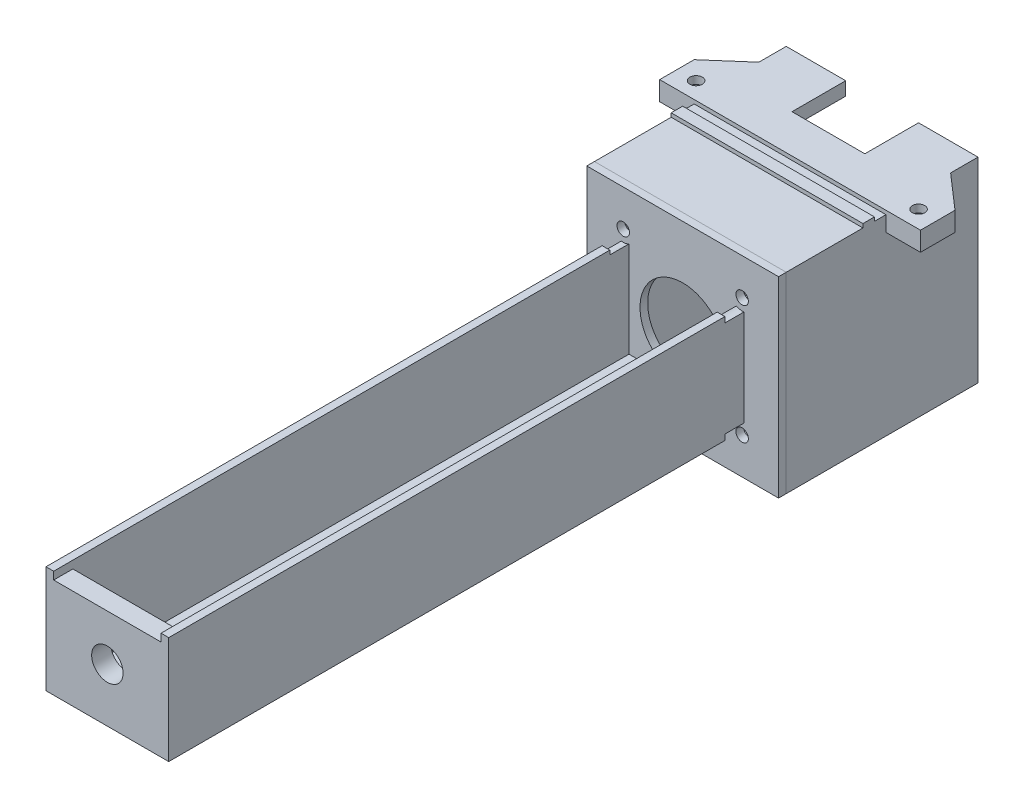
SolidWorks part; units mm, degrees
ref_plane "Front Plane" through (0, 0, 0) normal (0, 0, 1) x (1, 0, 0)
ref_plane "Top Plane" through (0, 0, 0) normal (0, 1, 0) x (1, 0, 0)
ref_plane "Right Plane" through (0, 0, 0) normal (1, 0, 0) x (0, 0, -1)
sketch "Croquis1" plane through (0, 0, 0) normal (0, 0, 1) x (1, 0, 0)
  line L1 (-22.5, -22.5) -> (22.5, -22.5)
  line L2 (-22.5, -22.5) -> (-22.5, 22.5)
  line L3 (-22.5, 22.5) -> (22.5, 22.5)
  line L4 (22.5, -22.5) -> (22.5, 22.5)
  line L5 (-22.5, -22.5) -> (22.5, 22.5) construction
  line L6 (-22.5, 22.5) -> (22.5, -22.5) construction
  line L7 (-25, -25) -> (25, -25)
  line L8 (-25, -25) -> (-25, 25)
  line L9 (-25, 25) -> (25, 25)
  line L10 (25, -25) -> (25, 25)
  line L11 (-25, -25) -> (25, 25) construction
  line L12 (-25, 25) -> (25, -25) construction
  point P0 (0, 0)
  point P5 (0, 0)
  dimension "D1" = 45
  dimension "D2" = 45
  dimension "D3" = 50
  dimension "D4" = 50
extrude "Saliente-Extruir1" add sketch "Croquis1" along normal blind 50
sketch "Croquis2" plane through (0, 0, 50) normal (0, 0, 1) x (1, 0, 0)
  line L0 (25, -25) -> (25, 25) construction
  line L1 (-25, -25) -> (25, -25)
  line L2 (-25, -25) -> (-25, 25)
  line L3 (-25, 25) -> (25, 25)
  line L4 (25, -25) -> (25, 25)
  line L5 (-25, -25) -> (25, 25) construction
  line L6 (-25, 25) -> (25, -25) construction
  line L11 (-15.5, -15.5) -> (15.5, 15.5) construction
  line L12 (-15.5, 15.5) -> (15.5, -15.5) construction
  line L17 (-11, -11) -> (11, 11) construction
  line L18 (-11, 11) -> (11, -11) construction
  circle A0 centre (-15.5, 15.5) radius 1.625
  circle A1 centre (15.5, 15.5) radius 1.625
  circle A2 centre (15.5, -15.5) radius 1.625
  circle A3 centre (-15.5, -15.5) radius 1.625
  circle A4 centre (0, 0) radius 11.125
  point P0 (0, 0)
  point P5 (0, 0)
  point P16 (0, 0)
  dimension "D3" = 3.25
  dimension "D4" = 3.25
  dimension "D5" = 3.25
  dimension "D6" = 3.25
  dimension "D9" = 22.25
  dimension "D1" = 31
  dimension "D2" = 31
  dimension "D7" = 22
  dimension "D8" = 22
extrude "Saliente-Extruir2" add sketch "Croquis2" along normal blind 2 separate body
sketch "Croquis4" plane through (0, 0, 52) normal (0, 0, 1) x (1, 0, 0)
  line L0 (-16, 14) -> (-16, -14)
  line L1 (-16, -14) -> (16, -14)
  line L2 (16, -14) -> (16, 14)
  line L3 (16, 14) -> (14, 14)
  line L4 (14, 14) -> (14, -12)
  line L5 (14, -12) -> (-14, -12)
  line L6 (-14, -12) -> (-14, 14)
  line L7 (-14, 14) -> (-16, 14)
  dimension "D1" = 2
  dimension "D2" = 2
  dimension "D3" = 2
  dimension "D4" = 28
  dimension "D5" = 26
  dimension "D6" = 14
  dimension "D7" = 32
extrude "Saliente-Extruir3" add sketch "Croquis4" along normal blind 150
sketch "Croquis7" plane through (0, 25, 0) normal (0, 1, 0) x (1, 0, 0)
  line L0 (9.5, 0) -> (9.5, -14)
  line L1 (25, 0) -> (-25, 0) construction
  line L2 (9.5, -14) -> (-9.5, -14)
  line L3 (-9.5, -14) -> (-9.5, 0)
  line L4 (-9.5, 0) -> (9.5, 0)
  dimension "D1" = 14
  dimension "D2" = 19
  dimension "D3" = 9.5
extrude "Cortar-Extruir1" cut sketch "Croquis7" against normal blind 4
sketch "Croquis8" plane through (0, 25, 0) normal (0, 1, 0) x (1, 0, 0)
  line L5 (25, -50) -> (25, 0) construction
  line L6 (-9.5, -14) -> (9.5, -14)
  line L7 (-25, -14) -> (-25, -24)
  line L12 (-25, -24) -> (25, -24)
  line L13 (25, -14) -> (25, -24)
  line L14 (-25, -14) -> (25, -24) construction
  line L15 (-25, -24) -> (25, -14) construction
  line L16 (-9.5, 0) -> (-25, 0) construction
  line L17 (-9.5, -14) -> (9.5, -14) construction
  line L19 (-25, -30) -> (25, -30)
  line L20 (-25, -30) -> (-25, -27)
  line L21 (-25, -27) -> (25, -27)
  line L22 (25, -30) -> (25, -27)
  line L23 (-25, -30) -> (25, -27) construction
  line L24 (-25, -27) -> (25, -30) construction
  line L25 (-25, 0) -> (-9.5, 0)
  line L26 (-25, 0) -> (-25, -14)
  line L28 (-9.5, 0) -> (-9.5, -14)
  line L29 (9.5, 0) -> (25, 0)
  line L30 (9.5, 0) -> (9.5, -14)
  line L32 (25, 0) -> (25, -14)
  point P0 (0, -19)
  point P11 (0, -28.5)
  dimension "D1" = 24
  dimension "D2" = 3
  dimension "D3" = 3
extrude "Saliente-Extruir4" add sketch "Croquis8" along normal blind 1
sketch "Croquis9" plane through (0, 26, 0) normal (0, 1, 0) x (1, 0, 0)
  line L0 (-34, -15) -> (-25, -7.1377)
  line L1 (25, -24) -> (34, -24)
  line L2 (25, -24) -> (25, -15)
  line L4 (34, -24) -> (34, -15)
  line L5 (-25, -24) -> (-34, -24)
  line L6 (-25, -24) -> (-25, -15)
  line L8 (-34, -24) -> (-34, -15)
  line L9 (-25, 0) -> (-25, -24) construction
  line L10 (-25, -7.1377) -> (-25, -15)
  line L11 (34, -15) -> (25, -7.1377)
  line L12 (25, -24) -> (25, 0) construction
  line L13 (25, -7.1377) -> (25, -15)
  dimension "D1" = 9
  dimension "D2" = 9
  dimension "D3" = 9
  dimension "D4" = 9
extrude "Saliente-Extruir5" add sketch "Croquis9" against normal blind 5
sketch "Croquis10" plane through (0, 21, 0) normal (0, -1, 0) x (1, 0, 0)
  line L0 (25, 24) -> (34, 24) construction
  line L1 (34, 24) -> (34, 15) construction
  line L2 (-34, 24) -> (-25, 24) construction
  line L3 (-34, 15) -> (-34, 24) construction
  circle A0 centre (29, 19.5) radius 3
  circle A1 centre (-29, 19.5) radius 3
  dimension "D1" = 6
  dimension "D2" = 6
  dimension "D3" = 4.5
  dimension "D4" = 5
  dimension "D5" = 4.5
  dimension "D6" = 5
extrude "Cortar-Extruir2" cut sketch "Croquis10" against normal blind 3
sketch "Croquis11" plane through (0, 24, 0) normal (0, -1, 0) x (1, 0, 0)
  circle A0 centre (29, 19.5) radius 1.625
  circle A1 centre (-29, 19.5) radius 1.625
  dimension "D1" = 3.25
  dimension "D2" = 3.25
extrude "Cortar-Extruir3" cut sketch "Croquis11" against normal blind 5
sketch "Croquis13" plane through (0, 0, 202) normal (0, 0, 1) x (1, 0, 0)
  line L1 (-14, 12) -> (14, 12)
  line L2 (-14, 12) -> (-14, -12)
  line L3 (-14, -12) -> (14, -12)
  line L4 (14, 12) -> (14, -12)
  line L5 (-14, 12) -> (14, -12) construction
  line L6 (-14, -12) -> (14, 12) construction
  circle A0 centre (0, 0) radius 4.1
  dimension "D1" = 8.2
  dimension "D2" = 14
  dimension "D3" = 12
extrude "Saliente-Extruir6" add sketch "Croquis13" against normal blind 5
sketch "Croquis15" plane through (0, 0, 52) normal (0, 0, 1) x (1, 0, 0)
  circle A0 centre (-15.5, 15.5) radius 3
  circle A1 centre (15.5, 15.5) radius 3
  circle A2 centre (15.5, -15.5) radius 3
  circle A3 centre (-15.5, -15.5) radius 3
  dimension "D1" = 6
  dimension "D2" = 6
  dimension "D3" = 6
  dimension "D4" = 6
extrude "Cortar-Extruir4" cut sketch "Croquis15" along normal blind 5
